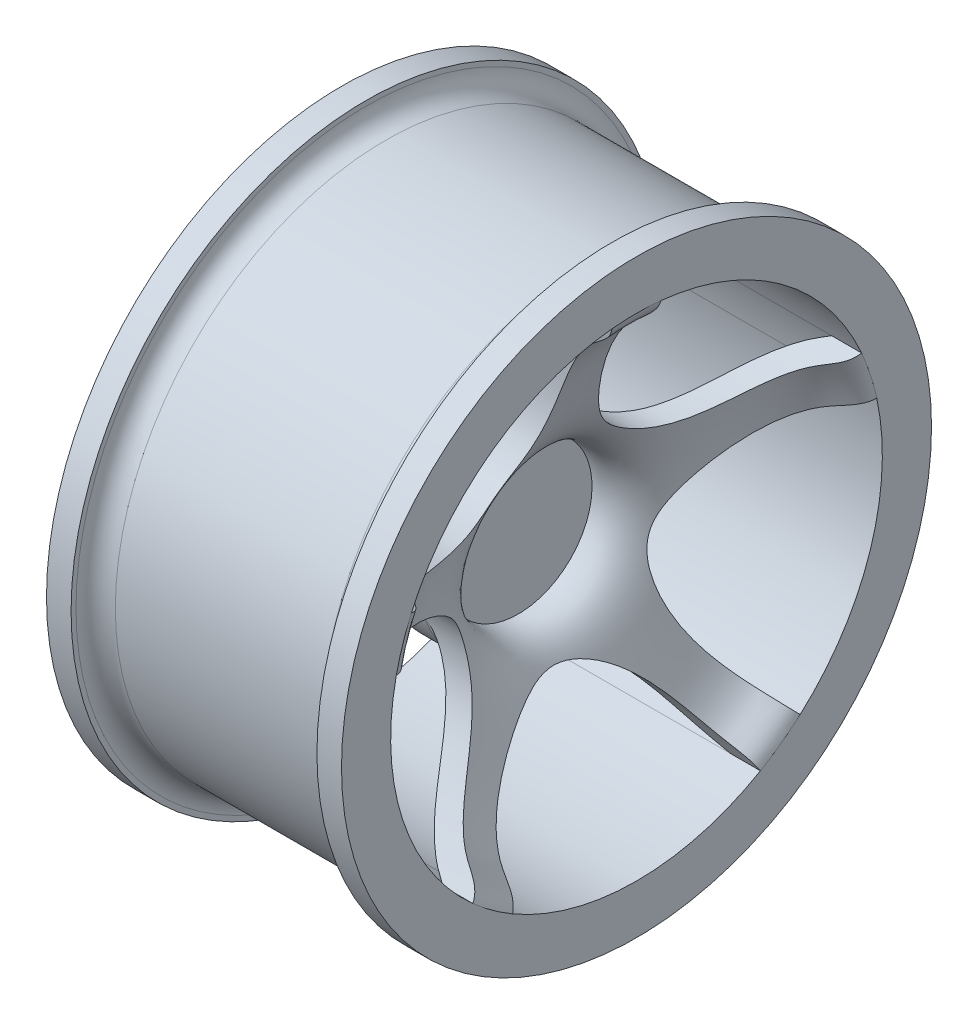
SolidWorks part; units mm, degrees
ref_plane "Front Plane" through (0, 0, 0) normal (0, 0, 1) x (1, 0, 0)
ref_plane "Top Plane" through (0, 0, 0) normal (0, 1, 0) x (1, 0, 0)
ref_plane "Right Plane" through (0, 0, 0) normal (1, 0, 0) x (0, 0, -1)
sketch "Sketch1" plane through (0, 0, 0) normal (0, 0, 1) x (1, 0, 0)
  line L0 (0, 0) -> (38.1, 0) construction
  line L1 (0, 0) -> (0, 12.7) construction
  line L2 (-26.67, 69.85) -> (26.67, 69.85)
  line L3 (31.75, 74.93) -> (31.75, 76.2)
  line L4 (31.75, 76.2) -> (38.1, 76.2)
  line L5 (38.1, 76.2) -> (38.1, 63.5)
  line L6 (30.3845, 63.5) -> (0, 63.5)
  line L7 (-31.75, 74.93) -> (-31.75, 76.2)
  line L8 (-38.1, 76.2) -> (-38.1, 63.5)
  line L9 (-31.75, 76.2) -> (-38.1, 76.2)
  line L11 (7.5659, 25.4) -> (0, 25.4)
  line L12 (0, 25.4) -> (0, 19.05)
  line L14 (-6.35, 12.7) -> (0, 12.7)
  line L15 (-38.1, 63.5) -> (0, 63.5)
  line L16 (0, 12.7) -> (7.5659, 12.7)
  line L17 (7.5659, 12.7) -> (7.5659, 19.05)
  line L18 (0, 19.05) -> (-6.35, 19.05)
  line L19 (0, 19.05) -> (0, 69.85) construction
  line L20 (-6.35, 19.05) -> (-6.35, 12.7)
  arc A0 (26.67, 69.85) -> (31.75, 74.93) centre (26.67, 74.93) ccw
  arc A1 (-26.67, 69.85) -> (-31.75, 74.93) centre (-26.67, 74.93) cw
  spline S0 degree 3 poles (7.5659, 19.05) (22.4282, 19.05) (19.9296, 51.8037) (37.3521, 60.1986) (38.1, 63.5) knots 0 0 0 0 0.823077 1 1 1 1
  spline S1 degree 1 poles (7.5659, 25.4) (31.91, 64.9164) knots 0 0 1 1 construction
  spline S2 degree 3 poles (7.5659, 25.4) (7.6883, 25.4) (7.9454, 25.4087) (8.3598, 25.4533) (8.7832, 25.5476) (9.1971, 25.7065) (9.7327, 26.0049) (10.5084, 26.6525) (11.6438, 28.1458) (12.8345, 30.3593) (14.4018, 34.1045) (15.9172, 38.7454) (17.5801, 43.7862) (18.9872, 47.6697) (20.6517, 51.5641) (22.3591, 54.747) (23.9954, 57.1999) (25.3837, 58.9757) (26.6805, 60.3725) (27.8374, 61.4436) (28.9397, 62.3721) (29.905, 63.1195) (30.6762, 63.7305) (31.3045, 64.253) (31.6966, 64.6361) (31.8761, 64.862) (31.8945, 64.8901) (31.91, 64.9164) knots 0 0 0 0 0.015062 0.030125 0.060249 0.090374 0.120498 0.180747 0.240996 0.301245 0.361494 0.481992 0.542241 0.60249 0.662739 0.722988 0.753113 0.783237 0.813362 0.828424 0.843486 0.873745 0.888808 0.903735 0.93386 0.948922 0.963984 0.963984 0.963984 0.963984 only from (7.5659, 25.4) to (30.3845, 63.5)
  point P11 (31.75, 69.85)
  dimension "D7" = 5.08
  dimension "D1" = 69.85
  dimension "D2" = 38.1
  dimension "D3" = 12.7
  dimension "D4" = 6.35
  dimension "D5" = 6.35
  dimension "D6" = 38.1
  dimension "D8" = 6.35
  dimension "D10" = 6.35
  dimension "D9" = 6.35
  dimension "D12" = 6.35
  dimension "D11" = 6.35
revolve "Revolve1" add sketch "Sketch1" angle 360 about L0
sketch "Sketch14" plane through (-38.1, 0, 0) normal (-1, 0, 0) x (0, 0, 1)
  circle A0 centre (0, 0) radius 12.7 construction
  circle A1 centre (0, 0) radius 76.2
  circle A2 centre (0, 0) radius 76.2
  circle A3 centre (0, 0) radius 12.7
  circle A4 centre (0, 0) radius 19.05 construction
  circle A5 centre (0, 0) radius 19.05
  dimension "D1" = 0
extrude "Boss-Extrude4" add sketch "Sketch14" against normal up to surface (31.75 mm away) contours A5 A3
sketch "Sketch15" plane through (7.5659, 0, 0) normal (1, 0, 0) x (0, 0, -1)
  circle A1 centre (0, 0) radius 19.05
  circle A2 centre (0, 0) radius 19.05
  dimension "D1" = 0
extrude "Boss-Extrude5" add sketch "Sketch15" against normal blind 7.62
sketch "Sketch16" plane through (38.1, 0, 0) normal (1, 0, 0) x (0, 0, -1)
  circle A5 centre (0, 0) radius 63.5 construction
  arc A6 (-6.35, 63.1817) -> (-58.1303, 25.5561) centre (-0.0019, 0.0026) ccw
  spline S0 degree 2 poles (-58.1303, 25.5561) (3.7089, -2.4916) (-6.35, 63.1817) knots 0 0 0 1 1 1
  dimension "D1" = 25.4
extrude "Cut-Extrude1" cut sketch "Sketch16" against normal through all
pattern_circular "CirPattern1" count 5 over 360 about axis through (7.5659, 12.7, 0) along (-1, 0, 0) of "Cut-Extrude1"
